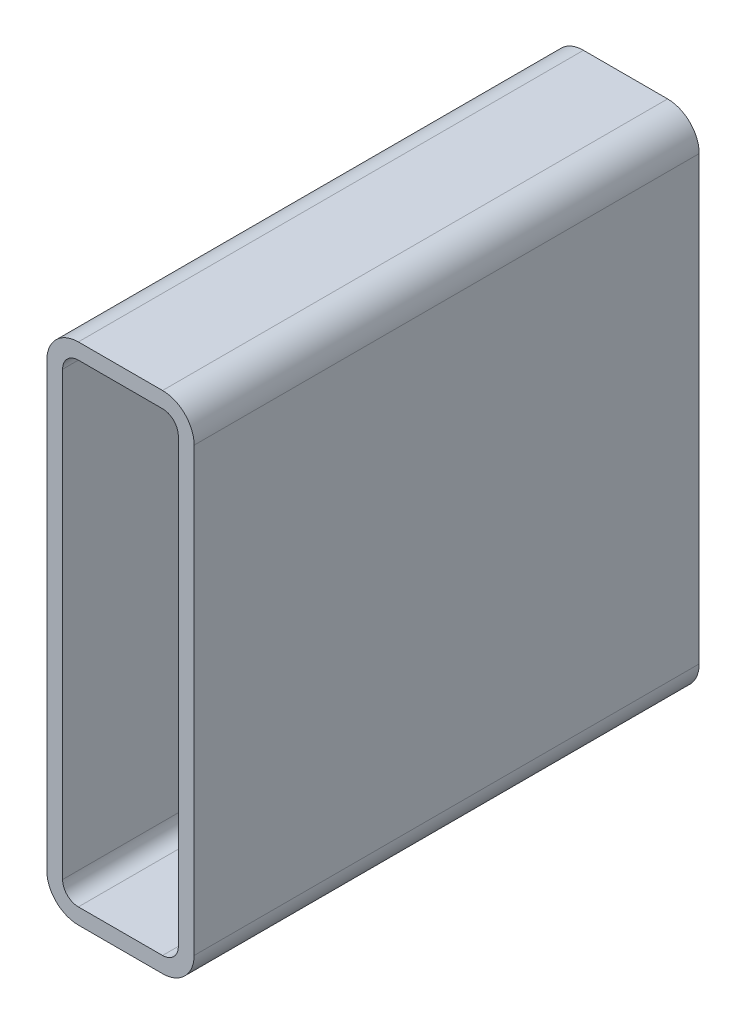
SolidWorks part; units mm, degrees
ref_plane "Front Plane" through (0, 0, 0) normal (0, 0, 1) x (1, 0, 0)
ref_plane "Top Plane" through (0, 0, 0) normal (0, 1, 0) x (1, 0, 0)
ref_plane "Right Plane" through (0, 0, 0) normal (1, 0, 0) x (0, 0, -1)
sketch "Sketch1" plane through (0, 0, 0) normal (0, 0, 1) x (1, 0, 0)
sketch_block_instance "HSS12x3.5x0.375-1"
sketch_block "HSS12x3.5x0.375"
extrude "Boss-Extrude1" add sketch "Sketch1" along normal blind 304.8
